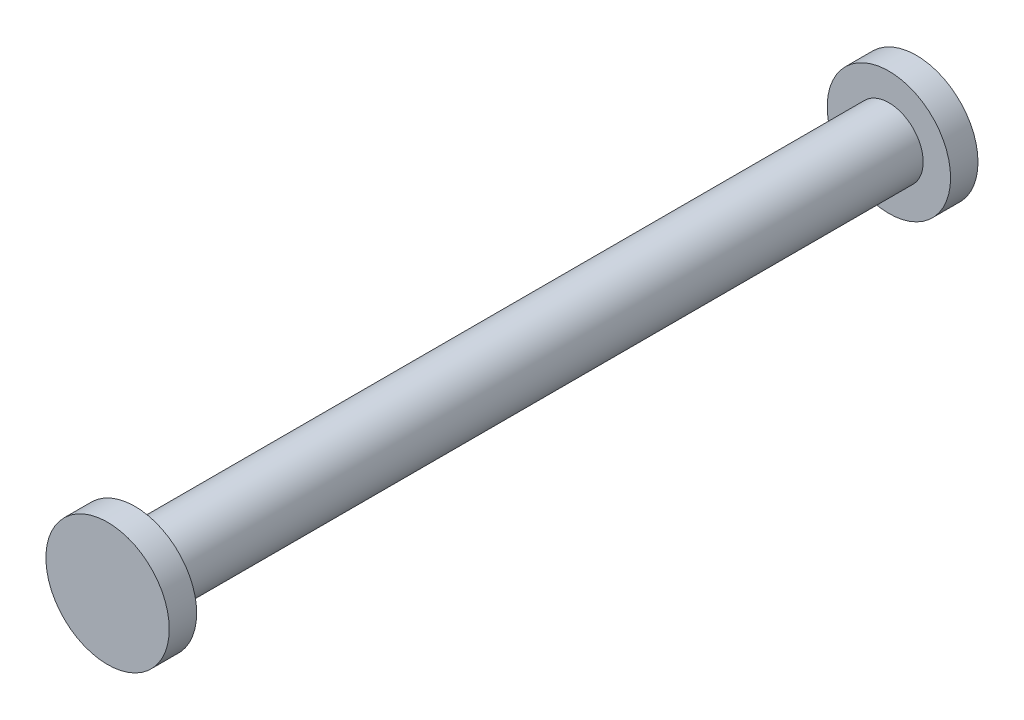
SolidWorks part; units mm, degrees
ref_plane "前视基准面" through (0, 0, 0) normal (0, 0, 1) x (1, 0, 0)
ref_plane "上视基准面" through (0, 0, 0) normal (0, 1, 0) x (1, 0, 0)
ref_plane "右视基准面" through (0, 0, 0) normal (1, 0, 0) x (0, 0, -1)
other "Configuration Table"
sketch "草图1" plane through (0, 0, 0) normal (0, 0, 1) x (1, 0, 0)
  circle A0 centre (0, 0) radius 4.5
  dimension "D1" = 9
extrude "Arm_Hinge_Pin_Blank" add sketch "草图1" against normal mid plane 59
sketch "草图2" plane through (0, 0, 0) normal (0, 0, 1) x (1, 0, 0)
  circle A0 centre (0, 0) radius 4.6
  circle A1 centre (0, 0) radius 2.5
  dimension "D1" = 5
  dimension "D2" = 9.2
extrude "D5_Shaft_and_End_Retainers" cut sketch "草图2" against normal mid plane 55
